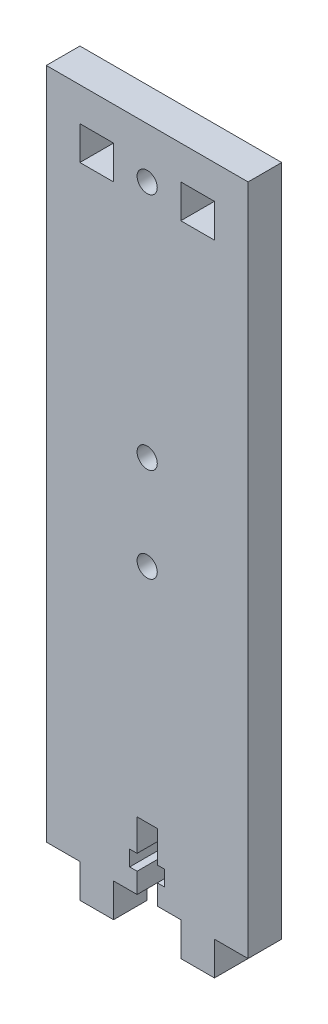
SolidWorks part; units mm, degrees
ref_plane "Plan de face" through (0, 0, 0) normal (0, 0, 1) x (1, 0, 0)
ref_plane "Plan de dessus" through (0, 0, 0) normal (0, 1, 0) x (1, 0, 0)
ref_plane "Plan de droite" through (0, 0, 0) normal (1, 0, 0) x (0, 0, -1)
sketch "Esquisse1" plane through (0, 0, 0) normal (0, 0, 1) x (1, 0, 0)
  line L0 (-10, 0) -> (-15, 0)
  line L1 (-15, 0) -> (-15, 90)
  line L2 (-15, 90) -> (15, 90) construction
  line L3 (15, 90) -> (15, 0)
  line L4 (15, 0) -> (10, 0)
  line L5 (0, 0) -> (0, 11.2208) construction
  line L6 (-1.5, 0) -> (-5, 0)
  line L7 (-5, -5) -> (-10, -5)
  line L8 (-10, -5) -> (-10, 0)
  line L9 (-5, -5) -> (-5, 0)
  line L10 (1.5, 0) -> (5, 0)
  line L11 (5, 0) -> (5, -5)
  line L12 (0, 0) -> (0, 90) construction
  line L13 (5, -5) -> (10, -5)
  line L14 (10, -5) -> (10, 0)
  line L15 (-1.5, 0) -> (1.5, 0) construction
  line L16 (1.5, 0) -> (1.5, 3)
  line L17 (1.5, 5.3) -> (2.6, 5.3)
  line L18 (-2.6, 3) -> (-2.6, 5.3)
  line L19 (2.6, 3) -> (1.5, 3)
  line L20 (1.5, 5.3) -> (1.5, 10)
  line L21 (1.5, 10) -> (-1.5, 10)
  line L22 (-1.5, 10) -> (-1.5, 5.3)
  line L23 (-1.5, 3) -> (-2.6, 3)
  line L24 (2.6, 5.3) -> (2.6, 3)
  line L25 (-2.6, 5.3) -> (-1.5, 5.3)
  line L26 (-1.5, 3) -> (-1.5, 0)
  line L27 (0, 10) -> (0, 0) construction
  line L28 (-15, 90) -> (-15, 100)
  line L29 (-15, 100) -> (15, 100)
  line L30 (15, 100) -> (15, 90)
  circle A0 centre (0, 57) radius 1.5
  circle A1 centre (0, 43) radius 1.5
  line B0 (-5, 95) -> (-10, 95)
  line B1 (-5, 95) -> (-5, 90)
  line B2 (-5, 90) -> (-10, 90)
  line B3 (-10, 95) -> (-10, 90)
  line B4 (5, 95) -> (10, 95)
  line B5 (5, 95) -> (5, 90)
  line B6 (5, 90) -> (10, 90)
  line B7 (10, 95) -> (10, 90)
  line B8 (0, 92.5) -> (0, 99.4724) construction
  circle B9 centre (0, 92.5) radius 1.5
  dimension "D3" = 30
  dimension "D6" = 3
  dimension "D1" = 14
  dimension "D2" = 90
  dimension "D4" = 5
  dimension "D5" = 43
  dimension "D7" = 10
  dimension "D8" = 5
  dimension "D9" = 5
  dimension "D10" = 5.2
  dimension "D11" = 3
  dimension "D12" = 2.3
  dimension "D13" = 3
  dimension "D14" = 10
sketch_block_instance "Trou M3 plots 5mm-1"
sketch_block "Trou M3 plots 5mm" parameters "D2"=3, "D1"=5, "D3"=5, "D4"=10
extrude "Boss.-Extru.1" add sketch "Esquisse1" along normal blind 5
